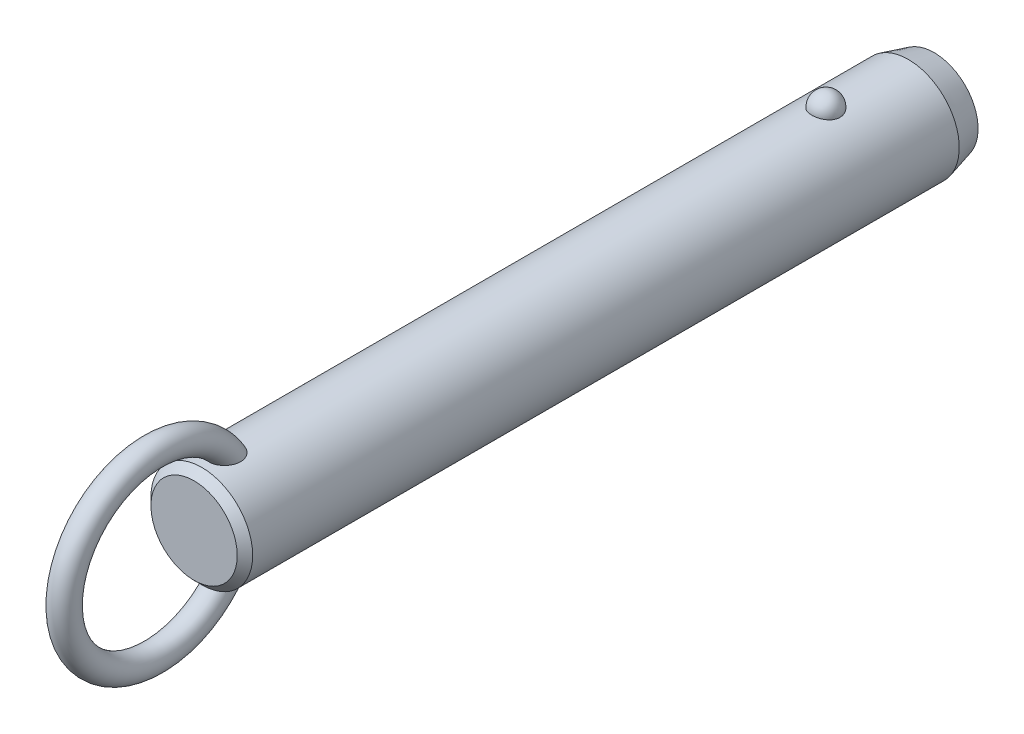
SolidWorks part; units mm, degrees
ref_plane "Front Plane" through (0, 0, 0) normal (0, 0, 1) x (1, 0, 0)
ref_plane "Top Plane" through (0, 0, 0) normal (0, 1, 0) x (1, 0, 0)
ref_plane "Right Plane" through (0, 0, 0) normal (1, 0, 0) x (0, 0, -1)
sketch "Sketch2" plane through (0, 0, 0) normal (0, 0, 1) x (1, 0, 0)
  circle A0 centre (0, 0) radius 7.9
  point P3 (0, 7.9)
  dimension "D1" = 15.8
extrude "Boss-Extrude1" add sketch "Sketch2" along normal blind 86.4
sketch "Sketch3" plane through (0, 0, 0) normal (0, 0, -1) x (-1, 0, 0)
  circle A0 centre (0, 0) radius 7.9
  dimension "D1" = 15.8
extrude "Boss-Extrude2" add sketch "Sketch3" along normal blind 19
chamfer "Chamfer1" distance 4 angle 15 1 edges at (-7.9, 0, -19)
sketch "Sketch12" plane through (0, 0, 0) normal (1, 0, 0) x (0, 0, -1)
  line L0 (-86.4, 7.9) -> (-86.4, -7.9) construction
  point P0 (-86.4, 0)
sketch "Sketch13" plane through (0, 0, 0) normal (1, 0, 0) x (0, 0, -1)
  circle A0 centre (-102.25, 0) radius 15.85
  point P2 (-86.4, 0)
  dimension "D1" = 31.7
sketch "Sketch14" plane through (0, 0, 0) normal (0, 1, 0) x (1, 0, 0)
  circle A0 centre (0, -88.4) radius 2
  point P2 (0, -86.4)
  dimension "D1" = 4
sweep "Sweep1" add profiles "Sketch14" path "Sketch13"
sketch "Sketch15" plane through (0, 0, 86.4) normal (0, 0, 1) x (1, 0, 0)
  circle A0 centre (0, 0) radius 7.9
  dimension "D1" = 15.8
extrude "Boss-Extrude3" add sketch "Sketch15" along normal blind 9.52
chamfer "Chamfer2" distance 1.2 angle 45 1 edges at (7.9, 0, 95.92)
sketch "Sketch18" plane through (0, 0, 0) normal (1, 0, 0) x (0, 0, -1)
  line L0 (15, 7.9) -> (-88.5091, 7.9) construction
  line L1 (2.2, 10.1) -> (2.2, 5.7)
  line L2 (-88.5091, -7.9) -> (15, -7.9) construction
  arc A0 (2.2, 10.1) -> (2.2, 5.7) centre (2.2, 7.9) ccw
  point P4 (0, 7.9)
  dimension "D1" = 18
revolve "Revolve1" add sketch "Sketch18" angle 360 about L1
